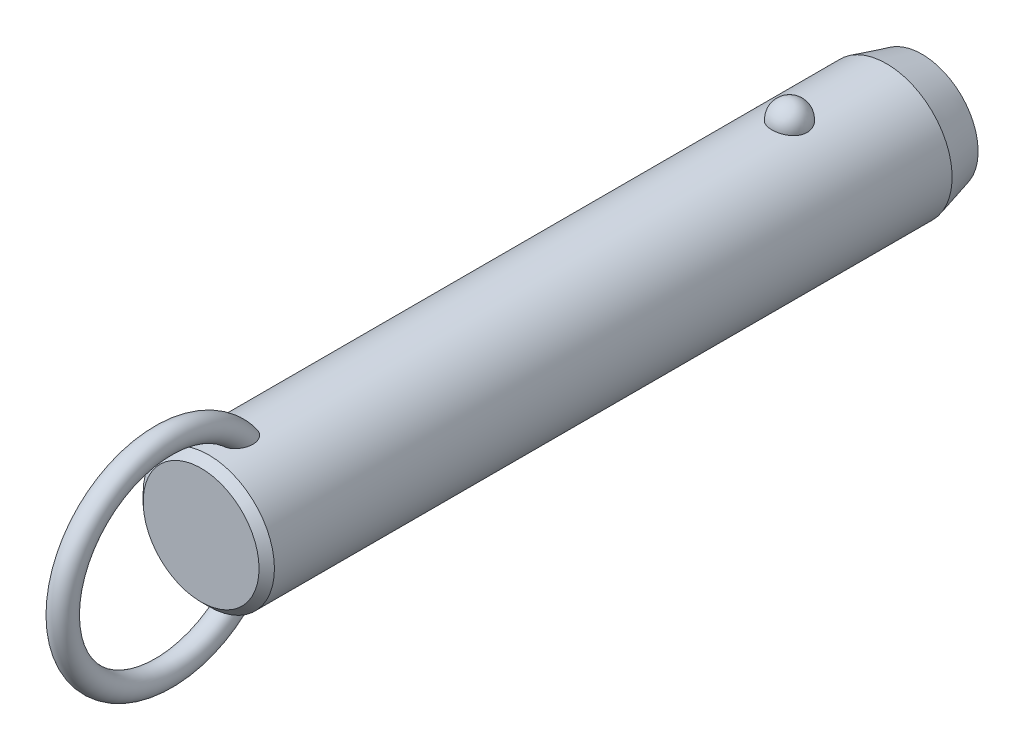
SolidWorks part; units mm, degrees
ref_plane "Front Plane" through (0, 0, 0) normal (0, 0, 1) x (1, 0, 0)
ref_plane "Top Plane" through (0, 0, 0) normal (0, 1, 0) x (1, 0, 0)
ref_plane "Right Plane" through (0, 0, 0) normal (1, 0, 0) x (0, 0, -1)
sketch "Sketch2" plane through (0, 0, 0) normal (0, 0, 1) x (1, 0, 0)
  circle A0 centre (0, 0) radius 11.1
  point P3 (0, 11.1)
  dimension "D1" = 22.2
extrude "Boss-Extrude1" add sketch "Sketch2" along normal blind 83.8
sketch "Sketch3" plane through (0, 0, 0) normal (0, 0, -1) x (-1, 0, 0)
  circle A0 centre (0, 0) radius 11.1
  dimension "D1" = 22.2
extrude "Boss-Extrude2" add sketch "Sketch3" along normal blind 25.4
chamfer "Chamfer1" distance 6 angle 15 1 edges at (-11.1, 0, -25.4)
sketch "Sketch12" plane through (0, 0, 0) normal (1, 0, 0) x (0, 0, -1)
  line L0 (-83.8, 11.1) -> (-83.8, -11.1) construction
  point P0 (-83.8, 0)
sketch "Sketch13" plane through (0, 0, 0) normal (1, 0, 0) x (0, 0, -1)
  circle A0 centre (-102.85, 0) radius 19.05
  point P2 (-83.8, 0)
  dimension "D1" = 38.1
sketch "Sketch14" plane through (0, 0, 0) normal (0, 1, 0) x (1, 0, 0)
  circle A0 centre (0, -85.8) radius 2
  point P2 (0, -83.8)
  dimension "D1" = 4
sweep "Sweep1" add profiles "Sketch14" path "Sketch13"
sketch "Sketch15" plane through (0, 0, 83.8) normal (0, 0, 1) x (1, 0, 0)
  circle A0 centre (0, 0) radius 11.1
  dimension "D1" = 22.2
extrude "Boss-Extrude3" add sketch "Sketch15" along normal blind 12.7
chamfer "Chamfer2" distance 1.3 angle 45 1 edges at (11.1, 0, 96.5)
sketch "Sketch18" plane through (0, 0, 0) normal (1, 0, 0) x (0, 0, -1)
  line L0 (19.4, 11.1) -> (-87.368, 11.1) construction
  line L1 (3, 14.1) -> (3, 8.1)
  line L2 (-87.368, -11.1) -> (19.4, -11.1) construction
  arc A0 (3, 14.1) -> (3, 8.1) centre (3, 11.1) ccw
  point P4 (0, 11.1)
  dimension "D1" = 25.2
revolve "Revolve1" add sketch "Sketch18" angle 360 about L1
